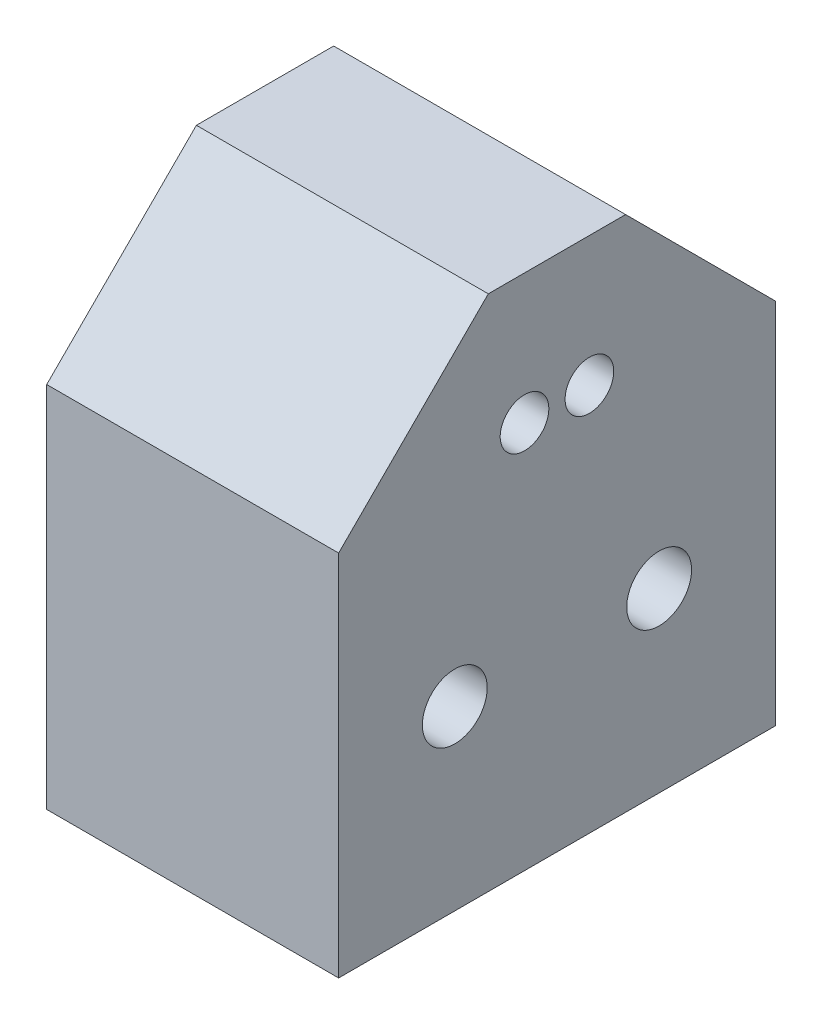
SolidWorks part; units mm, degrees
ref_plane "Front Plane" through (0, 0, 0) normal (0, 0, 1) x (1, 0, 0)
ref_plane "Top Plane" through (0, 0, 0) normal (0, 1, 0) x (1, 0, 0)
ref_plane "Right Plane" through (0, 0, 0) normal (1, 0, 0) x (0, 0, -1)
sketch "Sketch1" plane through (0, 0, 0) normal (1, 0, 0) x (0, 0, -1)
  line L2 (-19.0815, 35.7715) -> (-9.853, 45)
  line L3 (-9.853, 45) -> (-1.3866, 45)
  line L4 (-1.3866, 45) -> (7.8418, 35.7715)
  line L6 (-19.0815, 35.7715) -> (-19.0815, 13.0799)
  line L7 (7.8418, 35.7715) -> (7.8418, 13.0799)
  line L8 (-19.0815, 13.0799) -> (7.8418, 13.0799)
  dimension "D8" = 135
  dimension "D9" = 135
extrude "Boss-Extrude1" add sketch "Sketch1" along normal blind 18
sketch "Sketch2" plane through (18, 0, 0) normal (1, 0, 0) x (0, 0, -1)
  line L0 (-9.853, 45) -> (-9.853, 15.0715) construction
  line L1 (-1.3866, 45) -> (-1.3866, 15.0715) construction
  line L5 (-1.3866, 45) -> (-9.853, 45) construction
  circle A0 centre (-7.6198, 37) radius 1.5
  circle A1 centre (-3.6198, 37) radius 1.5
  circle A2 centre (-11.9198, 24) radius 2
  circle A3 centre (0.6802, 24) radius 2
  point P12 (-1.3866, 45)
  dimension "D1" = 3
  dimension "D2" = 3
  dimension "D5" = 8
  dimension "D3" = 4
  dimension "D4" = 4
  dimension "D10" = 21
  dimension "D11" = 13
  dimension "9.5" = 8
extrude "Cut-Extrude2" cut sketch "Sketch2" against normal through all contours A3 | A0 | A1 | A2
